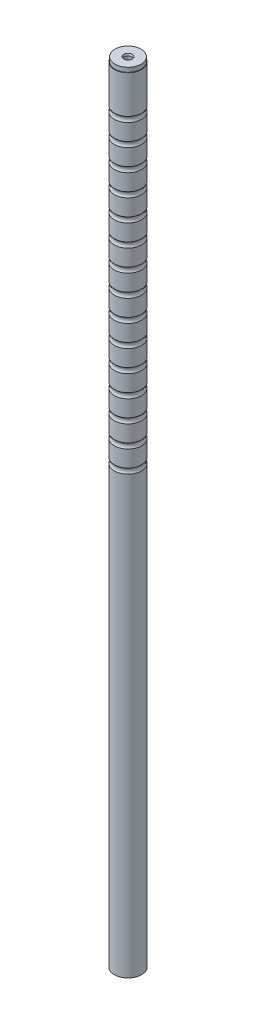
SolidWorks part; units mm, degrees
ref_plane "Front Plane" through (0, 0, 0) normal (0, 0, 1) x (1, 0, 0)
ref_plane "Top Plane" through (0, 0, 0) normal (0, 1, 0) x (1, 0, 0)
ref_plane "Right Plane" through (0, 0, 0) normal (1, 0, 0) x (0, 0, -1)
sketch "Sketch1" plane through (0, 0, 0) normal (0, 1, 0) x (1, 0, 0)
  circle A0 centre (0, 0) radius 7.9375
  dimension "D1" = 15.875
extrude "Extrude1" add sketch "Sketch1" along normal blind 460.248
sketch "Sketch2" plane through (0, 460.248, 0) normal (0, 1, 0) x (-1, 0, 0)
  point P0 (0, 0)
hole_wizard "#10-32 Tapped Hole1" positions "3DSketch1" profile "Sketch3" tap size "#10-32" standard "Ansi Inch"
sketch3d "3DSketch1"
  point P0 (0, 460.248, 0)
sketch "Sketch3" plane through (0, 460.248, 0) normal (1, 0, 0) x (0, 0, 1)
  line L0 (0, 0) -> (0, 14.9293)
  line L1 (0, 14.9293) -> (2.0193, 13.716)
  line L2 (2.0193, 13.716) -> (2.0193, 0.9811)
  line L3 (2.0193, 0.9811) -> (2.4257, 0)
  line L5 (2.4257, 0) -> (0, 0)
  line L6 (-2.0193, 0.9811) -> (-2.4257, 0) construction
  line L10 (0, 14.9293) -> (-2.0193, 13.716) construction
  line L11 (0, -6.35) -> (0, 107.95) construction
  dimension "Tap Drill Dia." = 4.0386
  dimension "Tap Drill Depth" = 13.716
  dimension "Near C'Sink Dia." = 4.8514
  dimension "Near C'Sink Angle" = 45
  dimension "Drill Angle" = 118
sketch "Sketch4" plane through (0, 0, 0) normal (0, -1, 0) x (1, 0, 0)
  point P0 (0, 0)
hole_wizard "1/4-20 Tapped Hole1" positions "3DSketch2" profile "Sketch5" tap size "1/4-20" standard "Ansi Inch"
sketch3d "3DSketch2"
  point P0 (0, 0, 0)
sketch "Sketch5" plane through (0, 0, 0) normal (1, 0, 0) x (0, 0, -1)
  line L0 (0, 0) -> (0, 20.5838)
  line L1 (0, 20.5838) -> (2.5527, 19.05)
  line L2 (2.5527, 19.05) -> (2.5527, 1.809)
  line L3 (2.5527, 1.809) -> (3.302, 0)
  line L5 (3.302, 0) -> (0, 0)
  line L6 (-2.5527, 1.809) -> (-3.302, 0) construction
  line L10 (0, 20.5838) -> (-2.5527, 19.05) construction
  line L11 (0, -6.35) -> (0, 107.95) construction
  dimension "Tap Drill Dia." = 5.1054
  dimension "Tap Drill Depth" = 19.05
  dimension "Near C'Sink Dia." = 6.604
  dimension "Near C'Sink Angle" = 45
  dimension "Drill Angle" = 118
sketch "Sketch6" plane through (0, 0, 0) normal (0, 0, 1) x (1, 0, 0)
  line L1 (7.9375, 460.248) -> (-7.9375, 460.248) construction
  line L6 (0, 460.248) -> (0, 0) construction
  circle A0 centre (9.7472, 434.086) radius 2.3813
  dimension "D4" = 4.7625
  dimension "D5" = 14.732
  dimension "D1" = 26.162
revolve "Cut-Revolve1" cut sketch "Sketch6" angle 360 about axis through (0, 460.248, 0) along (0, -1, 0)
pattern_linear "LPattern1" count 15 spacing 12.7 along (0, -1, 0) of "Cut-Revolve1"
sketch "Sketch8" plane through (0, 460.248, 0) normal (0, 1, 0) x (1, 0, 0)
  circle A0 centre (0, 0) radius 7.62
extrude "Cut-Extrude2" cut sketch "Sketch8" against normal blind 2.54 flip side to cut
